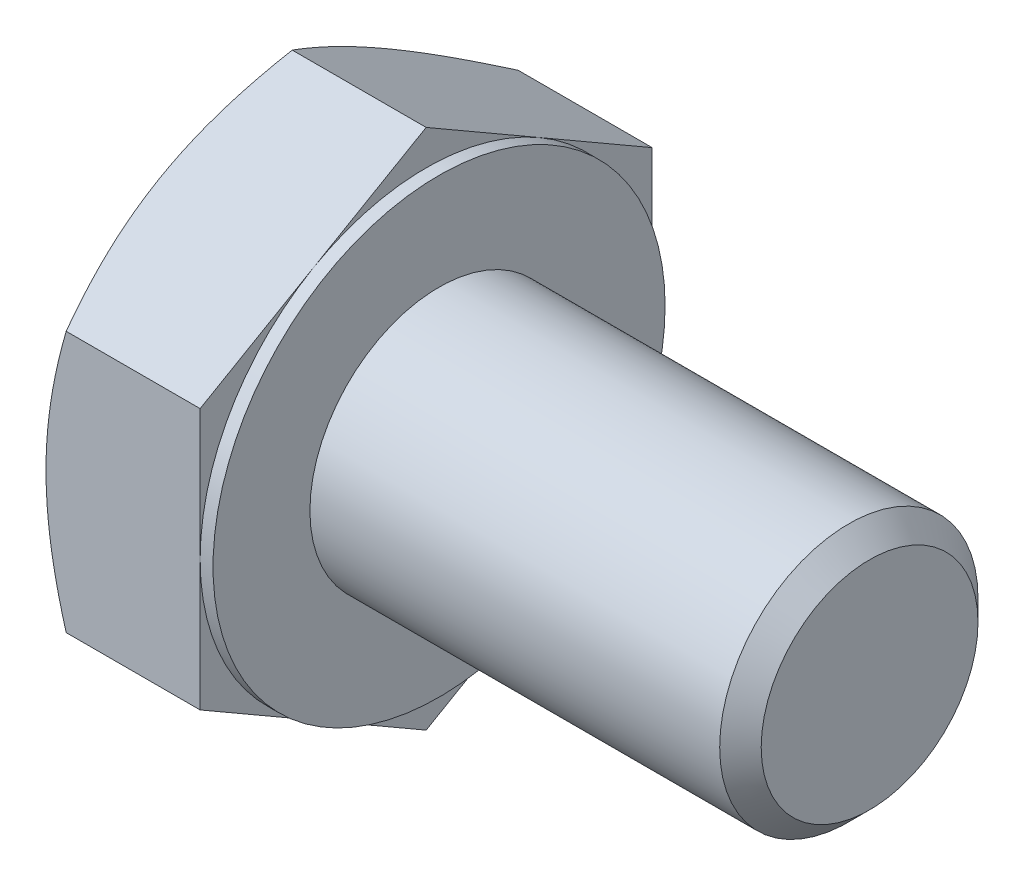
SolidWorks part; units mm, degrees
ref_plane "Plane1" through (0, 0, 0) normal (0, 0, 1) x (1, 0, 0)
ref_plane "Plane2" through (0, 0, 0) normal (0, 1, 0) x (1, 0, 0)
ref_plane "Plane3" through (0, 0, 0) normal (1, 0, 0) x (0, 0, -1)
extrude "BaseHead" add sketch "Sketch1" along normal blind 7.76
sketch "Sketch1" plane through (0, 0, 0) normal (1, 0, 0) x (0, 0, -1)
  line L0 (10.5, 6.0622) -> (10.5, -6.0622)
  line L1 (-10.5, 6.0622) -> (-10.5, -6.0622)
  line L2 (10.5, -6.0622) -> (0, -12.1244)
  line L3 (0, -12.1244) -> (-10.5, -6.0622)
  line L4 (10.5, 6.0622) -> (0, 12.1244)
  line L5 (0, 12.1244) -> (-10.5, 6.0622)
  dimension "Width_flats" = 21
  dimension "D2" = 120
  dimension "D3" = 10.5
  dimension "D4" = 10.5
  dimension "D5" = 10.5
revolve "BaseBody" add sketch "BodySke"
sketch "BodySke" plane through (0, 0, 0) normal (0, 0, 1) x (1, 0, 0)
  line L0 (0, 6.0622) -> (0, -6.0622) construction
  line L1 (0, 0) -> (27.76, 0)
  line L2 (0, 0) -> (0, 6)
  line L3 (0, 6) -> (26.796, 6)
  line L4 (27.76, 0) -> (27.76, 5.036)
  line L5 (7.76, 12.1244) -> (7.76, 6.0622) construction
  line L6 (27.76, 5.036) -> (26.796, 6)
  line L7 (0, 0) -> (96.52, 0) construction
  line L8 (27.76, -5.036) -> (26.796, -6) construction
  line L9 (0, -6) -> (26.796, -6) construction
  line L10 (9.51, 15.24) -> (9.51, -1.27) construction
  line L11 (7.76, 15.24) -> (7.76, -1.27) construction
  line L12 (7.76, 6.0622) -> (7.76, -6.0622) construction
  dimension "Length" = 20
  dimension "Body_ch_ang" = 45
  dimension "Diameter" = 12
  dimension "Minor_dia" = 10.072
  dimension "Advance" = 1.75
  dimension "Thread_nom" = 20
fillet "HeadFillet" radius 0.6
sketch "Sketch3" plane through (0, 0, 0) normal (0, 0, 1) x (1, 0, 0)
  line L0 (0, 10.5) -> (3.8246, 17.1244)
  line L1 (0, 12.1244) -> (0, 6.0622) construction
  line L2 (3.8246, 17.1244) -> (3.8246, 22.1244)
  line L3 (3.8246, 22.1244) -> (-10, 22.1244)
  line L4 (-10, 22.1244) -> (-10, 10.5)
  line L5 (-10, 10.5) -> (0, 10.5)
  line L6 (0, 0) -> (99.06, 0) construction
  line L7 (7.76, 12.1244) -> (0, 12.1244) construction
  dimension "D1" = 10.5
  dimension "D2" = 5
  dimension "D3" = 10
  dimension "D4" = 5
  dimension "Head_ch_ang" = 30
revolve "HeadChamfer" cut sketch "Sketch3" angle 360 about L6
sketch "Sketch4" plane through (0, 0, 0) normal (0, 0, 1) x (1, 0, 0)
  line L1 (7.76, 12.1244) -> (7.76, 6.0622) construction
  line L2 (7.76, 10.5) -> (7.16, 10.5)
  line L3 (7.76, 10.5) -> (7.76, 22.1244)
  line L4 (7.76, 22.1244) -> (7.16, 22.1244)
  line L5 (0, 0) -> (95.25, 0) construction
  line L6 (0, 0) -> (96.52, 0) construction
  line L7 (7.16, 10.5) -> (7.16, 22.1244)
  line L8 (7.76, 12.1244) -> (0.9378, 12.1244) construction
  dimension "D1" = 21
  dimension "D2" = 10
  dimension "Bearing_ht" = 0.6
revolve "BearingFace" cut sketch "Sketch4" angle 360 about L5
sketch "ThdSchSke" plane through (0, 0, 0) normal (0, 0, 1) x (1, 0, 0)
  line L0 (9.51, -5.036) -> (8.835, -6)
  line L1 (9.51, -5.036) -> (10.185, -6)
  line L2 (10.185, -6) -> (10.185, -7.5)
  line L3 (-3.175, 0) -> (5.1513, 0) construction
  line L5 (10.185, -7.5) -> (8.835, -7.5)
  line L6 (8.835, -7.5) -> (8.835, -6)
  dimension "Thread_minor" = 10.072
  dimension "Diameter" = 12
  dimension "Start" = 9.51
  dimension "SideAngle" = 55
  dimension "VeeAngle" = 70
  dimension "Overcut" = 15
revolve "ThreadSchematic" cut sketch "ThdSchSke" angle 360 about L3
pattern_linear "ThdSchPat"
equation "\"D3@Sketch1\" = \"Width_flats@Sketch1\" / 2"
equation "\"D4@Sketch1\" = \"D3@Sketch1\""
equation "\"D5@Sketch1\" = \"D4@Sketch1\""
equation "\"Thread_minor@ThreadCosmetic\" = \"Minor_dia@BodySke\""
equation "\"D1@Sketch3\" = \"Width_flats@Sketch1\" / 2"
equation "\"D1@Sketch4\" = \"Width_flats@Sketch1\""
equation "\"Thread_length@ThreadCosmetic\" = ((sgn( (\"Length@BodySke\" - \"Advance@BodySke\" ) - \"Thread_nom@BodySke\" )-1)*( (\"Length@BodySke\" - \"Advance@BodySke\" ) - \"Thread_nom@BodySke\" ))/-2+ \"Thread_nom@BodySke\""
equation "\"Thread_minor@ThdSchSke\" = \"Minor_dia@BodySke\""
equation "\"Diameter@ThdSchSke\" = \"Diameter@BodySke\""
equation "\"Overcut@ThdSchSke\" = \"Diameter@BodySke\" * 1.25"
equation "\"Start@ThdSchSke\" = \"Head_ht@BaseHead\" + \"Length@BodySke\" - \"Thread_length@ThreadCosmetic\"  '---Non-countersunk---"
equation "\"Num_threads@ThdSchPat\" = int( \"Thread_length@ThreadCosmetic\" / \"Advance@BodySke\" + 0.999 )  + 1"
equation "\"Advance@ThdSchPat\" = \"Thread_length@ThreadCosmetic\" /  (\"Num_threads@ThdSchPat\" - 1) 'relax it"
equation "\"Num_threads@ThdSchPat\" = \"Num_threads@ThdSchPat\" - sgn( \"Num_threads@ThdSchPat\" - 1) '---chamfered tips only---"
